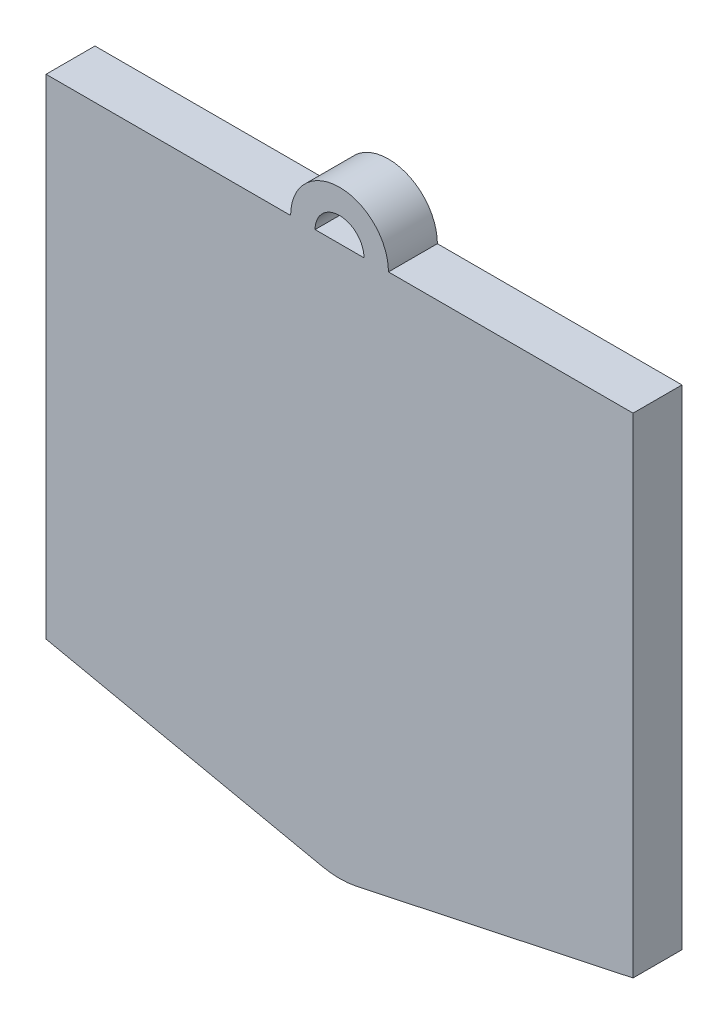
SolidWorks part; units mm, degrees
ref_plane "前视基准面" through (0, 0, 0) normal (0, 0, 1) x (1, 0, 0)
ref_plane "上视基准面" through (0, 0, 0) normal (0, 1, 0) x (1, 0, 0)
ref_plane "右视基准面" through (0, 0, 0) normal (1, 0, 0) x (0, 0, -1)
sketch "草图1" plane through (0, 0, 0) normal (0, 0, 1) x (1, 0, 0)
  line L0 (-18, 0) -> (18, 0)
  line L1 (-18, 0) -> (-18, -30)
  line L2 (18, 0) -> (18, -30)
  line L3 (-18, -30) -> (-1.0404, -33.608)
  line L4 (0, 8.7133) -> (0, -48.7422) construction
  line L5 (18, -30) -> (1.0404, -33.608)
  arc A0 (1.0404, -33.608) -> (-1.0404, -33.608) centre (0, -28.7174) cw
  point P9 (0, -33.8293)
  dimension "D4" = 5
  dimension "D1" = 36
  dimension "D2" = 102.01
  dimension "D3" = 30
extrude "凸台-拉伸1" add sketch "草图1" along normal blind 3
sketch "草图2" plane through (0, 0, 0) normal (0, 0, -1) x (-1, 0, 0)
  line L0 (-3, 0) -> (-1.5, 0)
  line L1 (1.5, 0) -> (3, 0)
  arc A0 (1.5, 0) -> (-1.5, 0) centre (0, 0) ccw
  arc A1 (3, 0) -> (-3, 0) centre (0, 0) ccw
  dimension "D1" = 1.5
  dimension "D2" = 3
extrude "凸台-拉伸3" add sketch "草图2" against normal up to surface (3 mm away)
